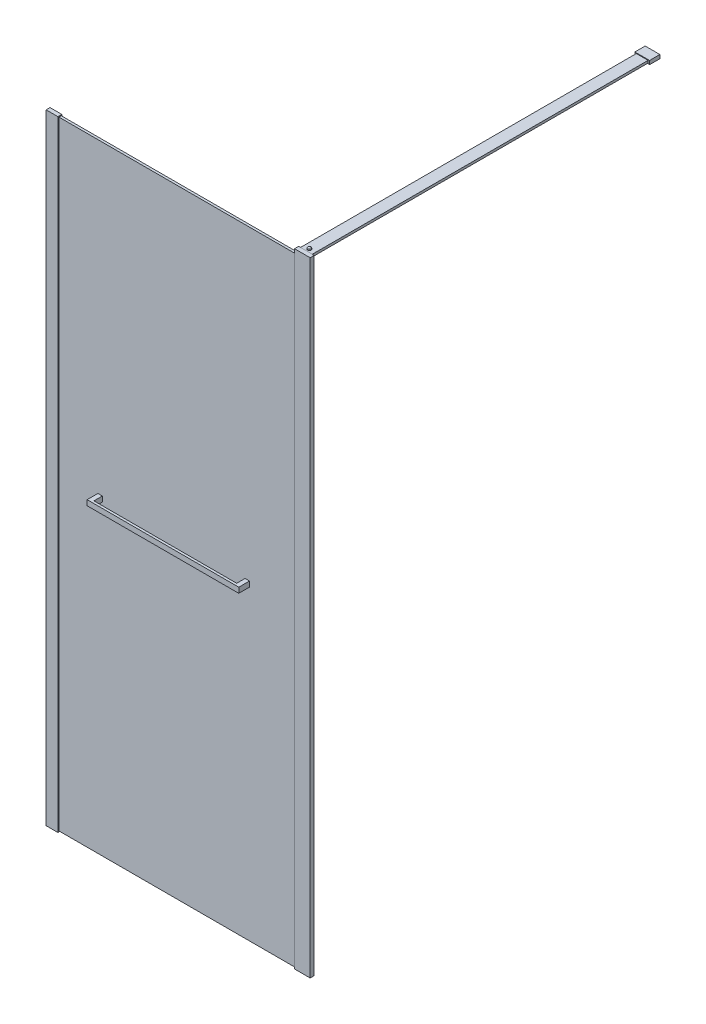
SolidWorks part; units mm, degrees
ref_plane "Płaszczyzna przednia" through (0, 0, 0) normal (0, 0, 1) x (1, 0, 0)
ref_plane "Płaszczyzna górna" through (0, 0, 0) normal (0, 1, 0) x (1, 0, 0)
ref_plane "Płaszczyzna prawa" through (0, 0, 0) normal (1, 0, 0) x (0, 0, -1)
sketch "Szkic1" plane through (0, 0, 0) normal (0, 1, 0) x (1, 0, 0)
  line L0 (0, 0) -> (0, 13.3)
  line L1 (0, 13.3) -> (40, 13.3)
  line L2 (40, 13.3) -> (40, 11.4)
  line L3 (40, 11.4) -> (6.5, 11.4)
  line L4 (6.5, 11.4) -> (6.5, 3.4)
  line L5 (6.5, 3.4) -> (40, 3.4)
  line L6 (40, 3.4) -> (40, 0)
  line L7 (40, 0) -> (0, 0)
  dimension "D1" = 40
  dimension "D2" = 13.3
  dimension "D3" = 33.5
  dimension "D4" = 1.9
  dimension "D5" = 8
extrude "Dodanie-wyciągnięcie1" add sketch "Szkic1" along normal blind 2100 from offset 3
sketch "Szkic2" plane through (0, 3, 0) normal (0, -1, 0) x (1, 0, 0)
  line L0 (6.5, -11.4) -> (40, -11.4) construction
  line L1 (6.5, -3.4) -> (853.5, -3.4)
  line L2 (6.5, -3.4) -> (6.5, -11.4)
  line L3 (6.5, -11.4) -> (853.5, -11.4)
  line L4 (853.5, -3.4) -> (853.5, -11.4)
  dimension "D1" = 847
extrude "Dodanie-wyciągnięcie2" add sketch "Szkic2" against normal blind 2100 separate body
sketch "Szkic3" plane through (0, 3, 0) normal (0, -1, 0) x (1, 0, 0)
  line L0 (843.4, -3.4) -> (843.4, -0.4)
  line L1 (853.5, -3.4) -> (6.5, -3.4) construction
  line L2 (843.4, -0.4) -> (896.4, -0.4)
  line L3 (896.4, -0.4) -> (896.4, -14.4)
  line L4 (896.4, -14.4) -> (843.4, -14.4)
  line L5 (843.4, -14.4) -> (843.4, -11.4)
  line L6 (843.4, -11.4) -> (853.5, -11.4)
  line L7 (853.5, -11.4) -> (853.5, -3.4)
  line L8 (853.5, -3.4) -> (843.4, -3.4)
  line L9 (6.5, -11.4) -> (853.5, -11.4) construction
  line L10 (853.5, -11.4) -> (853.5, -3.4) construction
  dimension "D1" = 10.1
  dimension "D2" = 3
  dimension "D3" = 3
  dimension "D4" = 53
extrude "Dodanie-wyciągnięcie3" add sketch "Szkic3" against normal blind 2108 separate body
sketch "Szkic4" plane through (0, 2103, 0) normal (0, 1, 0) x (1, 0, 0)
  line L1 (0, 13.3) -> (40, 13.3)
  line L2 (0, 13.3) -> (0, 0)
  line L3 (0, 0) -> (40, 0)
  line L4 (40, 13.3) -> (40, 0)
extrude "Dodanie-wyciągnięcie4" add sketch "Szkic4" along normal blind 3
sketch "Szkic5" plane through (0, 2111, 0) normal (0, 1, 0) x (1, 0, 0)
  line L1 (896.4, 14.4) -> (843.4, 14.4)
  line L2 (896.4, 14.4) -> (896.4, 0.4)
  line L3 (896.4, 0.4) -> (843.4, 0.4)
  line L4 (843.4, 14.4) -> (843.4, 0.4)
extrude "Dodanie-wyciągnięcie5" add sketch "Szkic5" along normal blind 8
sketch "Szkic6" plane through (843.4, 0, 0) normal (-1, 0, 0) x (0, 0, 1)
  line L0 (-11.4, 2111) -> (-3.4, 2111) construction
  line L1 (-3.35, 2111) -> (-11.45, 2111)
  line L2 (-3.35, 2111) -> (-3.35, 2103.2)
  line L3 (-3.35, 2103.2) -> (-11.45, 2103.2)
  line L4 (-11.45, 2111) -> (-11.45, 2103.2)
  point P6 (-7.4, 2111)
  dimension "D1" = 8.1
  dimension "D2" = 7.8
extrude "Dodanie-wyciągnięcie6" add sketch "Szkic6" against normal blind 15 from offset 1.3
sketch "Szkic7" plane through (0, 3, 0) normal (0, -1, 0) x (1, 0, 0)
  line L1 (843.4, -0.4) -> (896.4, -0.4)
  line L2 (843.4, -0.4) -> (843.4, -14.4)
  line L3 (843.4, -14.4) -> (896.4, -14.4)
  line L4 (896.4, -0.4) -> (896.4, -14.4)
extrude "Dodanie-wyciągnięcie7" add sketch "Szkic7" along normal blind 3
sketch "Szkic8" plane through (0, 3, 0) normal (0, -1, 0) x (1, 0, 0)
  line L1 (0, 0) -> (40, 0)
  line L2 (0, 0) -> (0, -13.3)
  line L3 (0, -13.3) -> (40, -13.3)
  line L4 (40, 0) -> (40, -13.3)
extrude "Dodanie-wyciągnięcie8" add sketch "Szkic8" along normal blind 3
sketch "Szkic9" plane through (0, 0, -14.4) normal (0, 0, -1) x (-1, 0, 0)
  line L0 (-896.4, 2119) -> (-843.4, 2119) construction
  line L1 (-889.9, 2119) -> (-849.9, 2119)
  line L2 (-889.9, 2119) -> (-889.9, 2111)
  line L3 (-889.9, 2111) -> (-849.9, 2111)
  line L4 (-849.9, 2119) -> (-849.9, 2111)
  line L5 (-896.4, 2119) -> (-896.4, 0) construction
  line L6 (-843.4, 2119) -> (-843.4, 0) construction
  dimension "D1" = 6.5
  dimension "D2" = 6.5
  dimension "D3" = 8
extrude "Dodanie-wyciągnięcie9" add sketch "Szkic9" along normal blind 1170 separate body
sketch "Szkic10" plane through (0, 0, -1184.4) normal (0, 0, -1) x (-1, 0, 0)
  line L0 (-869.9, 2119) -> (-869.9, 2115) construction
  line L1 (-894.9, 2121.25) -> (-844.9, 2121.25)
  line L2 (-894.9, 2121.25) -> (-894.9, 2108.75)
  line L3 (-894.9, 2108.75) -> (-844.9, 2108.75)
  line L4 (-844.9, 2121.25) -> (-844.9, 2108.75)
  line L5 (-894.9, 2121.25) -> (-844.9, 2108.75) construction
  line L6 (-894.9, 2108.75) -> (-844.9, 2121.25) construction
  line L7 (-849.9, 2119) -> (-889.9, 2119) construction
  line L8 (-869.9, 2115) -> (-889.9, 2115) construction
  line L9 (-889.9, 2119) -> (-889.9, 2111) construction
  point P0 (-869.9, 2115)
  dimension "D1" = 12.5
  dimension "D2" = 50
extrude "Dodanie-wyciągnięcie10" add sketch "Szkic10" along normal blind 35 from offset 29.4
ref_plane "Płaszczyzna1" through (869.9, 0, 0) normal (1, 0, 0) x (0, 0, -1)
sketch "Szkic11" plane through (869.9, 0, 0) normal (1, 0, 0) x (0, 0, -1)
  line L0 (24.4, 2119) -> (24.4, 2127.4416) construction
  line L1 (24.4, 2119) -> (34.6926, 2119) construction
  line L2 (30.3, 2119) -> (30.05, 2122.8)
  line L3 (24.4, 2124.7) -> (30.2413, 2124.7) construction
  line L4 (24.4, 2124.7) -> (24.4, 2124.2)
  line L5 (1155, 2119) -> (14.4, 2119) construction
  line L6 (14.4, 2119) -> (14.4, 2111) construction
  line L7 (29.7989, 2119) -> (30.3, 2119)
  line L9 (29.5663, 2122.5357) -> (29.7989, 2119)
  arc A0 (24.4, 2124.7) -> (30.05, 2122.8) centre (24.4, 2115.3493) cw
  arc A1 (29.5663, 2122.5357) -> (24.4, 2124.2) centre (24.4, 2115.3493) ccw
  dimension "D1" = 0.5
  dimension "D2" = 11.3
  dimension "D3" = 5.7
  dimension "D4" = 3.8
  dimension "D5" = 11.8
  dimension "D6" = 0.5
  dimension "D7" = 10
revolve "Obrót1" add sketch "Szkic11" angle 360 about L0
sketch "Szkic12" plane through (0, 0, -3.4) normal (0, 0, 1) x (1, 0, 0)
  line L0 (430, 1409.7928) -> (430, 762.3594) construction
  line L1 (180, 1053) -> (680, 1053) construction
  line L2 (6.5, 2103) -> (6.5, 3) construction
  line L3 (853.5, 2103) -> (853.5, 3) construction
  line L5 (172.5, 1062) -> (187.5, 1062)
  line L6 (172.5, 1062) -> (172.5, 1044)
  line L7 (172.5, 1044) -> (187.5, 1044)
  line L8 (187.5, 1062) -> (187.5, 1044)
  line L9 (172.5, 1062) -> (187.5, 1044) construction
  line L10 (172.5, 1044) -> (187.5, 1062) construction
  line L11 (672.5, 1062) -> (687.5, 1062)
  line L12 (672.5, 1062) -> (672.5, 1044)
  line L13 (672.5, 1044) -> (687.5, 1044)
  line L14 (687.5, 1062) -> (687.5, 1044)
  line L15 (672.5, 1062) -> (687.5, 1044) construction
  line L16 (672.5, 1044) -> (687.5, 1062) construction
  dimension "D1" = 1053
  dimension "D2" = 500
  dimension "D3" = 15
  dimension "D4" = 18
extrude "Dodanie-wyciągnięcie11" add sketch "Szkic12" along normal blind 36.5 and the other way blind 18 separate body
sketch "Szkic13" plane through (187.5, 0, 0) normal (1, 0, 0) x (0, 0, -1)
  line L0 (21.4, 1044) -> (-33.1, 1044) construction
  line L1 (-33.1, 1062) -> (-25.1, 1062)
  line L2 (-33.1, 1062) -> (-33.1, 1044)
  line L3 (-33.1, 1044) -> (-25.1, 1044)
  line L4 (-25.1, 1062) -> (-25.1, 1044)
  dimension "D1" = 8
extrude "Dodanie-wyciągnięcie12" add sketch "Szkic13" along normal up to surface (485 mm away)
